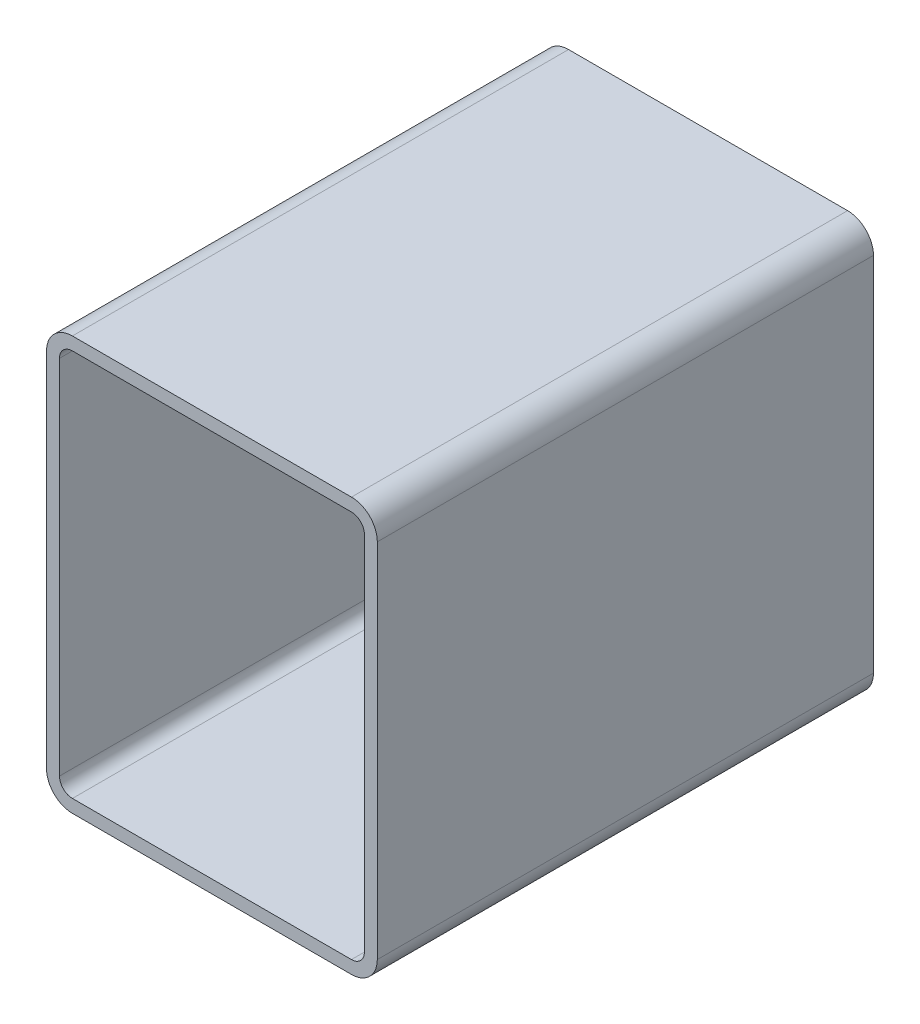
SolidWorks part; units mm, degrees
ref_plane "Front Plane" through (0, 0, 0) normal (0, 0, 1) x (1, 0, 0)
ref_plane "Top Plane" through (0, 0, 0) normal (0, 1, 0) x (1, 0, 0)
ref_plane "Right Plane" through (0, 0, 0) normal (1, 0, 0) x (0, 0, -1)
sketch "Sketch1" plane through (0, 0, 0) normal (0, 0, 1) x (1, 0, 0)
sketch_block_instance "HSS10x8x0.3125-1"
sketch_block "HSS10x8x0.3125"
extrude "Boss-Extrude1" add sketch "Sketch1" along normal blind 304.8
